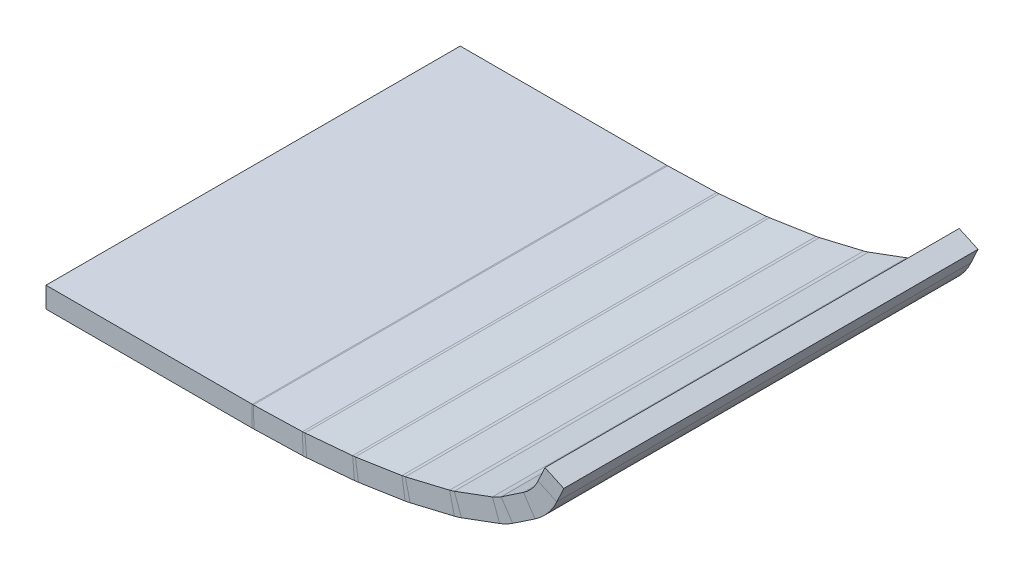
SolidWorks part; units mm, degrees
ref_plane "Ebene vorne" through (0, 0, 0) normal (0, 0, 1) x (1, 0, 0)
ref_plane "Ebene oben" through (0, 0, 0) normal (0, 1, 0) x (1, 0, 0)
ref_plane "Ebene rechts" through (0, 0, 0) normal (1, 0, 0) x (0, 0, -1)
sketch "Skizze1" plane through (0, 0, 0) normal (0, 0, 1) x (1, 0, 0)
  line L0 (0, 0) -> (20, 0)
  ellipse E0 centre (20, 10) end of major axis (-10, 10) minor radius 10 (50, 10) -> (20, 0) cw
  dimension "D1" = 20
  dimension "D2" = 60
  dimension "D3" = 20
extrude "Linear-Austragen-Dünn1" add sketch "Skizze1" along normal blind 40 thin
sketch "Skizze5" plane through (0, 0, 0) normal (0, 0, 1) x (1, 0, 0)
  line L0 (0, 0) -> (20, 0)
  line L1 (20, 0) -> (24.998, 0.1398)
  line L2 (24.998, 0.1398) -> (29.9795, 0.5695)
  line L3 (29.9795, 0.5695) -> (34.9222, 1.3248)
  line L4 (34.9222, 1.3248) -> (39.7861, 2.4833)
  line L5 (39.7861, 2.4833) -> (44.4757, 4.2175)
  line L6 (44.4757, 4.2175) -> (48.6251, 7.0073)
  line L7 (48.6251, 7.0073) -> (50, 10)
  ellipse E0 centre (20, 10) end of major axis (50, 10) minor radius 10 (20, 0) -> (50, 10) ccw construction
  dimension "D1" = 5
  dimension "D2" = 5
  dimension "D3" = 5
  dimension "D4" = 5
  dimension "D5" = 5
  dimension "D6" = 5
extrude "Linear-Austragen-Dünn2" add sketch "Skizze5" along normal blind 40 separate body thin
delete or keep bodies "Körper-Löschen1" type delete bodies bodies 105
sheet metal parameters "Blech2" parameters "D1"=4
bend "Biegung-Winkel1" bend angle 1.602 parameters "D1"=0, "D5"=1
flatten bends "Abwickeln2" parameters "D1"=0
sketch "Skizze-Winkel2" plane through (0, 2, 0) normal (0, 1, 0) x (-1, 0, 0)
  line L0 (-19.986, 40) -> (-19.986, 0) construction
  line L1 (-24.9429, 40) -> (-24.9429, 0) construction
  line L2 (-29.881, 40) -> (-29.881, 0) construction
  line L3 (-34.8069, 40) -> (-34.8069, 0) construction
  line L4 (-39.705, 40) -> (-39.705, 0) construction
  line L5 (-44.5222, 40) -> (-44.5222, 0) construction
  line L6 (-49.0834, 40) -> (-49.0834, 0) construction
bend "Biegung-Winkel2" bend angle 3.329 parameters "D1"=0, "D5"=2
bend "Biegung-Winkel3" bend angle 3.758 parameters "D1"=0, "D5"=3
bend "Biegung-Winkel4" bend angle 4.708 parameters "D1"=0, "D5"=4
bend "Biegung-Winkel5" bend angle 6.897 parameters "D1"=0, "D5"=5
bend "Biegung-Winkel6" bend angle 13.621 parameters "D1"=0, "D5"=6
bend "Biegung-Winkel7" bend angle 31.409 parameters "D1"=0, "D5"=7
process bends "Abbiegen2" parameters "D1"=0
sketch "Abwicklung-Skizze2" plane through (0, 2, 0) normal (0, 1, 0) x (-1, 0, 0)
flat pattern "Abwicklung2"
sketch "Biegung-Linien2" plane through (0, 2, 0) normal (0, 1, 0) x (-1, 0, 0)
  line L0 (-49.0834, 0) -> (-49.0834, 40) construction
  line L1 (-44.5222, 0) -> (-44.5222, 40) construction
  line L2 (-39.705, 0) -> (-39.705, 40) construction
  line L3 (-34.8069, 0) -> (-34.8069, 40) construction
  line L4 (-29.881, 0) -> (-29.881, 40) construction
  line L5 (-24.9429, 0) -> (-24.9429, 40) construction
  line L6 (-19.986, 0) -> (-19.986, 40) construction
  line L7 (-49.0834, 0) -> (-49.0834, 40) construction
  line L8 (-44.5222, 0) -> (-44.5222, 40) construction
  line L9 (-39.705, 0) -> (-39.705, 40) construction
  line L10 (-34.8069, 0) -> (-34.8069, 40) construction
  line L11 (-29.881, 0) -> (-29.881, 40) construction
  line L12 (-24.9429, 0) -> (-24.9429, 40) construction
  line L13 (-19.986, 0) -> (-19.986, 40) construction
bend of the flat pattern "Abwickeln-<Biegung-Winkel1>1"
bend of the flat pattern "Abwickeln-<Biegung-Winkel2>1"
bend of the flat pattern "Abwickeln-<Biegung-Winkel3>1"
bend of the flat pattern "Abwickeln-<Biegung-Winkel4>1"
bend of the flat pattern "Abwickeln-<Biegung-Winkel5>1"
bend of the flat pattern "Abwickeln-<Biegung-Winkel6>1"
bend of the flat pattern "Abwickeln-<Biegung-Winkel7>1"
